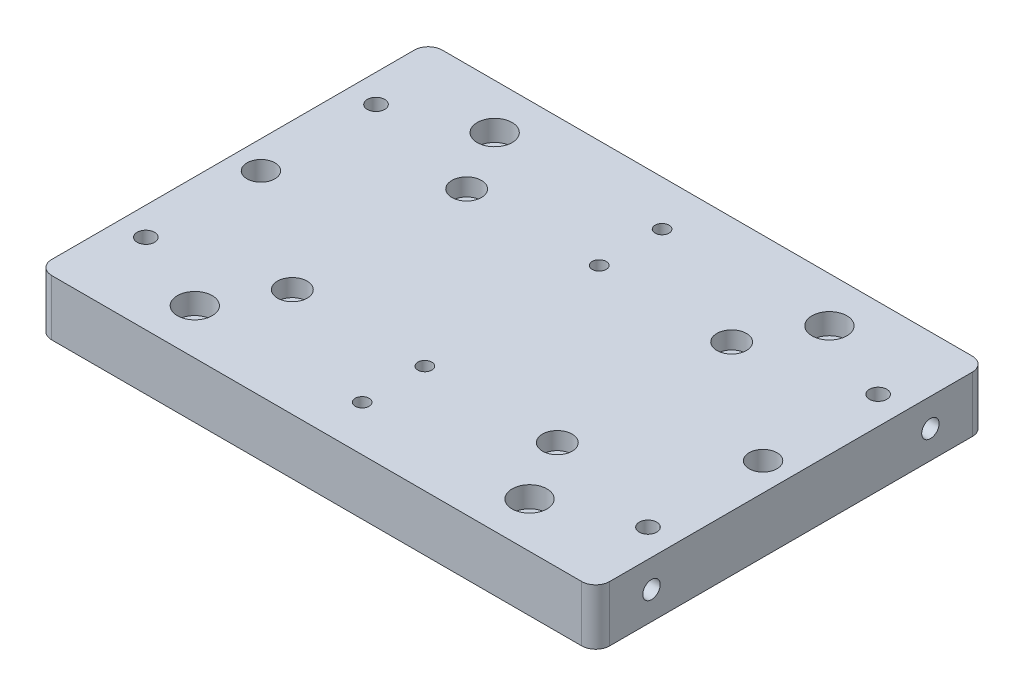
SolidWorks part; units mm, degrees
ref_plane "Front Plane" through (0, 0, 0) normal (0, 0, 1) x (1, 0, 0)
ref_plane "Top Plane" through (0, 0, 0) normal (0, 1, 0) x (1, 0, 0)
ref_plane "Right Plane" through (0, 0, 0) normal (1, 0, 0) x (0, 0, -1)
sketch "Sketch1" plane through (0, 0, 0) normal (0, 1, 0) x (1, 0, 0)
  line L1 (-127, 88.9) -> (127, 88.9)
  line L2 (-127, 88.9) -> (-127, -88.9)
  line L3 (-127, -88.9) -> (127, -88.9)
  line L4 (127, 88.9) -> (127, -88.9)
  line L5 (-127, 88.9) -> (127, -88.9) construction
  line L6 (-127, -88.9) -> (127, 88.9) construction
  point P0 (0, 0)
  dimension "D1" = 254
  dimension "D2" = 177.8
extrude "Boss-Extrude1" add sketch "Sketch1" along normal blind 25.4
hole_wizard "CBORE for 5/16 Socket Head Cap Screw1" positions "Sketch2" profile "Sketch3" counterbore size "5/16" standard "ANSI Inch"
sketch "Sketch2" plane through (0, 25.4, 0) normal (0, 1, 0) x (1, 0, 0)
  point P0 (-60.325, 39.6875)
  point P3 (60.325, 39.6875)
  point P6 (60.325, -39.6875)
  point P9 (-60.325, -39.6875)
sketch "Sketch3" plane through (-60.325, 25.4, -39.6875) normal (1, 0, 0) x (0, 0, 1)
  line L0 (0, 0) -> (0, 25.4)
  line L1 (0, 25.4) -> (4.2164, 25.4)
  line L3 (4.2164, 25.4) -> (4.2164, 7.9375)
  line L4 (4.2164, 7.9375) -> (6.7475, 7.9375)
  line L5 (6.7475, 7.9375) -> (6.7475, 0)
  line L7 (6.7475, 0) -> (0, 0)
  line L11 (0, -6.35) -> (0, 107.95) construction
  dimension "Thru Hole Dia." = 8.4328
  dimension "Thru Hole Depth" = 25.4
  dimension "C'Bore Dia." = 13.495
  dimension "C'Bore Depth" = 7.9375
hole_wizard "1/4 (0.2500) Dowel Hole1" positions "Sketch4" profile "Sketch5" hole size "1/4" standard "ANSI Inch"
sketch "Sketch4" plane through (0, 25.4, 0) normal (0, 1, 0) x (1, 0, 0)
  point P0 (0, -39.6748)
  point P3 (0, 39.7002)
sketch "Sketch5" plane through (0, 25.4, 39.6748) normal (1, 0, 0) x (0, 0, 1)
  line L0 (0, 0) -> (0, 25.4)
  line L1 (0, 25.4) -> (3.175, 25.4)
  line L2 (3.175, 25.4) -> (3.175, 0)
  line L5 (3.175, 0) -> (0, 0)
  line L11 (0, -6.35) -> (0, 107.95) construction
  dimension "Thru Hole Dia." = 6.35
  dimension "Thru Hole Depth" = 25.4
hole_wizard "3/8-16 Tapped Hole2" positions "Sketch6" profile "Sketch7" tap size "3/8-16" standard "ANSI Inch"
sketch "Sketch6" plane through (0, 25.4, 0) normal (0, 1, 0) x (1, 0, 0)
  point P0 (-114.3, 52.3875)
  point P3 (-114.3, -52.3875)
  point P6 (114.3, -52.3875)
  point P9 (114.3, 52.3875)
sketch "Sketch7" plane through (-114.3, 25.4, -52.3875) normal (1, 0, 0) x (0, 0, 1)
  line L0 (0, 0) -> (0, 25.4)
  line L1 (0, 25.4) -> (3.9687, 25.4)
  line L2 (3.9687, 25.4) -> (3.9687, 0)
  line L5 (3.9687, 0) -> (0, 0)
  line L11 (0, -6.35) -> (0, 107.95) construction
  dimension "Thru Tap Drill Dia." = 7.9375
  dimension "Thru Tap Drill Depth" = 25.4
hole_wizard "1/2 (0.5000) Dowel Hole1" positions "Sketch8" profile "Sketch9" hole size "1/2" standard "ANSI Inch"
sketch "Sketch8" plane through (0, 25.4, 0) normal (0, 1, 0) x (1, 0, 0)
  point P0 (-114.3, 0)
  point P3 (114.3, 0)
sketch "Sketch9" plane through (-114.3, 25.4, 0) normal (1, 0, 0) x (0, 0, 1)
  line L0 (0, 0) -> (0, 25.4)
  line L1 (0, 25.4) -> (6.35, 25.4)
  line L2 (6.35, 25.4) -> (6.35, 0)
  line L5 (6.35, 0) -> (0, 0)
  line L11 (0, -6.35) -> (0, 107.95) construction
  dimension "Thru Hole Dia." = 12.7
  dimension "Thru Hole Depth" = 25.4
hole_wizard "CBORE for 3/8 Socket Head Cap Screw1" positions "Sketch10" profile "Sketch11" counterbore size "3/8" standard "ANSI Inch"
sketch "Sketch10" plane through (0, 25.4, 0) normal (0, 1, 0) x (1, 0, 0)
  point P0 (76.2, 68.3133)
  point P3 (-76.2, 68.3133)
  point P6 (-76.2, -68.2117)
  point P9 (76.2, -68.2117)
sketch "Sketch11" plane through (76.2, 25.4, -68.3133) normal (1, 0, 0) x (0, 0, 1)
  line L0 (0, 0) -> (0, 25.4)
  line L1 (0, 25.4) -> (5.0419, 25.4)
  line L3 (5.0419, 25.4) -> (5.0419, 9.525)
  line L4 (5.0419, 9.525) -> (7.9375, 9.525)
  line L5 (7.9375, 9.525) -> (7.9375, 0)
  line L7 (7.9375, 0) -> (0, 0)
  line L11 (0, -6.35) -> (0, 107.95) construction
  dimension "Thru Hole Dia." = 10.0838
  dimension "Thru Hole Depth" = 25.4
  dimension "C'Bore Dia." = 15.875
  dimension "C'Bore Depth" = 9.525
hole_wizard "1/4 (0.2500) Dowel Hole2" positions "Sketch12" profile "Sketch13" hole size "1/4" standard "ANSI Inch"
sketch "Sketch12" plane through (0, 0, 0) normal (0, -1, 0) x (-1, 0, 0)
  point P0 (0, 68.326)
  point P3 (0, -68.199)
sketch "Sketch13" plane through (0, 0, -68.326) normal (1, 0, 0) x (0, 0, -1)
  line L0 (0, 0) -> (0, 25.4)
  line L1 (0, 25.4) -> (3.175, 25.4)
  line L2 (3.175, 25.4) -> (3.175, 0)
  line L5 (3.175, 0) -> (0, 0)
  line L11 (0, -6.35) -> (0, 107.95) construction
  dimension "Thru Hole Dia." = 6.35
  dimension "Thru Hole Depth" = 25.4
sketch "Sketch14" plane through (127, 0, 0) normal (1, 0, 0) x (0, 0, -1)
  line L4 (-88.9, 0) -> (88.9, 0)
  line L5 (88.9, 0) -> (88.9, 25.4)
  line L6 (88.9, 25.4) -> (-88.9, 25.4)
  line L9 (88.9, 0) -> (88.9, 25.4)
  line L10 (88.9, 25.4) -> (-88.9, 25.4)
  line L12 (-88.9, 0) -> (88.9, 0)
  line L14 (-88.9, 25.4) -> (-88.9, 0)
  line L15 (-88.9, 25.4) -> (-88.9, 0)
  dimension "D1" = 0
hole_wizard "3/8-16 Tapped Hole1" positions "Sketch15" profile "Sketch16" tap size "3/8-16" standard "ANSI Inch"
sketch "Sketch15" plane through (-127, 0, 15.875) normal (1, 0, 0) x (0, 0, -1)
  line L0 (104.775, 12.7) -> (79.375, 12.7) construction
  line L1 (104.775, 25.4) -> (104.775, 0) construction
  line L3 (15.875, 0) -> (15.875, -18.9262) construction
  line L4 (104.775, 0) -> (-73.025, 0) construction
  point P0 (-47.625, 12.7)
  point P3 (79.375, 12.7)
  dimension "D1" = 25.4
sketch "Sketch16" plane through (-127, 12.7, 63.5) normal (0, 1, 0) x (0, 0, 1)
  line L0 (0, 0) -> (0, 18.3867)
  line L1 (0, 18.3867) -> (3.9687, 16.002)
  line L2 (3.9687, 16.002) -> (3.9687, 0)
  line L5 (3.9687, 0) -> (0, 0)
  line L10 (0, 18.3867) -> (-3.9688, 16.002) construction
  line L11 (0, -6.35) -> (0, 107.95) construction
  dimension "Tap Drill Dia." = 7.9375
  dimension "Tap Drill Depth" = 16.002
  dimension "Drill Angle" = 118
fillet "Fillet1" radius 6.35 4 edges at (-127, 12.7, 88.9) (-127, 12.7, -88.9) (127, 12.7, -88.9) (127, 12.7, 88.9)
mirror "Mirror1" about plane through (0, 0, 0) normal (1, 0, 0) of "3/8-16 Tapped Hole1"
